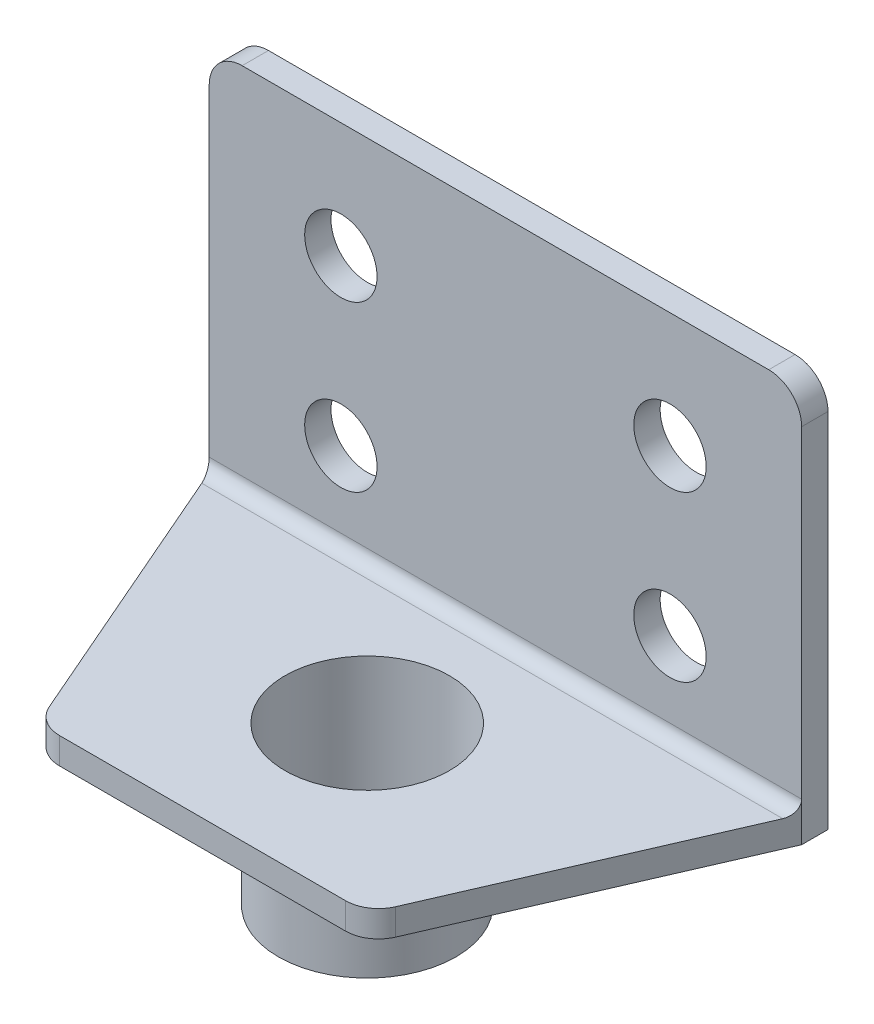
SolidWorks part; units mm, degrees
other "<Lower Linkage Bracket>-<Cut-Extrude2>"
ref_plane "Front Plane" through (0, 0, 0) normal (0, 0, 1) x (1, 0, 0)
ref_plane "Top Plane" through (0, 0, 0) normal (0, 1, 0) x (1, 0, 0)
ref_plane "Right Plane" through (0, 0, 0) normal (1, 0, 0) x (0, 0, -1)
mirrored part "Lower Linkage Bracket_Mirrored"
